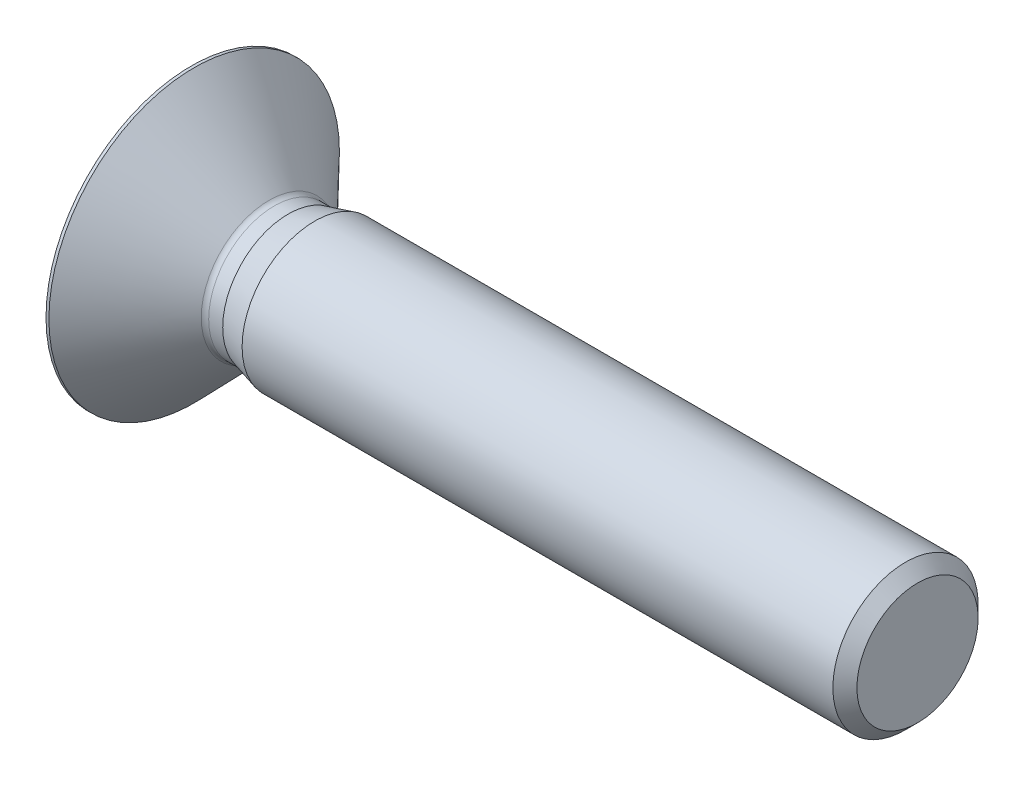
SolidWorks part; units mm, degrees
ref_plane "Front Plane" through (0, 0, 0) normal (0, 0, 1) x (1, 0, 0)
ref_plane "Top Plane" through (0, 0, 0) normal (0, 1, 0) x (1, 0, 0)
ref_plane "Right Plane" through (0, 0, 0) normal (1, 0, 0) x (0, 0, -1)
sketch "BodySke" plane through (0, 0, 0) normal (0, 0, 1) x (1, 0, 0)
  line L0 (0, 0) -> (88.9981, 0) construction
  line L1 (0, 0) -> (0, 10)
  line L2 (0, 10) -> (0.2, 10)
  line L3 (0.2, 10) -> (5.5, 4.5117)
  line L4 (5.5, 4.5117) -> (6.6776, 4.5117)
  line L5 (6.6776, 4.5117) -> (8.5, 5)
  line L6 (8.5, 5) -> (49.172, 5)
  line L7 (50, 4.172) -> (50, 0)
  line L8 (50, 0) -> (0, 0)
  line L9 (48.5, 0) -> (48.5, 7.7079) construction
  line L10 (49.172, 5) -> (50, 4.172)
  line L11 (0.2, -10) -> (5.5, -4.5117) construction
  dimension "Diameter" = 10
  dimension "Head_diameter" = 20
  dimension "Thread_minor" = 8.344
  dimension "Head_length" = 5.5
  dimension "D5" = 3
  dimension "Length" = 50
  dimension "Advance" = 1.5
  dimension "Angle" = 15
  dimension "Head_side" = 0.2
  dimension "End_chamfer_angle" = 45
  dimension "Head_angle" = 92
revolve "BaseBody" add sketch "BodySke" angle 360 about L0
fillet "Fillet1" radius 0.5 1 edges at (5.5, 0, 4.5117)
sketch "HexSke" plane through (0, 0, 0) normal (1, 0, 0) x (0, 0, -1)
  line L1 (0, 3.4641) -> (-3, 1.7321)
  line L2 (-3, 1.7321) -> (-3, -1.7321)
  line L3 (-3, -1.7321) -> (0, -3.4641)
  line L4 (0, -3.4641) -> (3, -1.7321)
  line L5 (3, -1.7321) -> (3, 1.7321)
  line L6 (3, 1.7321) -> (0, 3.4641)
  circle A0 centre (0, 0) radius 3 construction
  dimension "Hex_width" = 6
extrude "Hex" cut sketch "HexSke" along normal blind 4.4
sketch "Hex-PreBroachSke" plane through (0, 0, 0) normal (0, 0, 1) x (1, 0, 0)
  line L0 (0, 0) -> (21.7825, 0) construction
  line L1 (0, 10) -> (0, -10) construction
  line L2 (0, 0) -> (0, 3)
  line L3 (0, 3) -> (4.4, 3)
  line L4 (4.4, 3) -> (6.1321, 0)
  line L5 (6.1321, 0) -> (0, 0)
  dimension "D1" = 6
  dimension "D2" = 4.4
  dimension "Angle" = 60
revolve "Hex-PreBroach" cut sketch "Hex-PreBroachSke" angle 360 about L0
sketch "ThdSchSke" plane through (0, 0, 0) normal (0, 0, 1) x (1, 0, 0)
  line L0 (0, 0) -> (51.4372, 0) construction
  line L1 (0, 10) -> (0, -10) construction
  line L2 (47.672, 5.9561) -> (47.672, 5)
  line L3 (47.672, 5.9561) -> (48.6281, 5.9561)
  line L4 (48.6281, 5.9561) -> (48.6281, 5)
  line L5 (48.6281, 5) -> (48.15, 4.172)
  line L6 (48.15, 4.172) -> (47.672, 5)
  dimension "D1" = 1.5
revolve "ThreadSchematic" [suppressed] cut sketch "ThdSchSke" angle 360 about L0
pattern_linear "ThdSchPat" [suppressed]
equation "\"D5@BodySke\" = 2 * \"Advance@BodySke\""
equation "\"Thread_minor@ThreadCosmetic\" = \"Thread_minor@BodySke\""
equation "\"D1@Hex-PreBroachSke\" = \"Hex_width@HexSke\""
equation "\"D2@Hex-PreBroachSke\" = \"Hex_depth@Hex\""
equation "\"D1@ThdSchSke\" = \"Advance@BodySke\""
equation "\"Advance@ThdSchPat\" = \"Advance@BodySke\""
equation "\"Tooth_Num@ThdSchPat\" =  int( (  \"Length@BodySke\" - \"Head_length@BodySke\" - \"D5@BodySke\" )  / \"Advance@BodySke\" ) "
